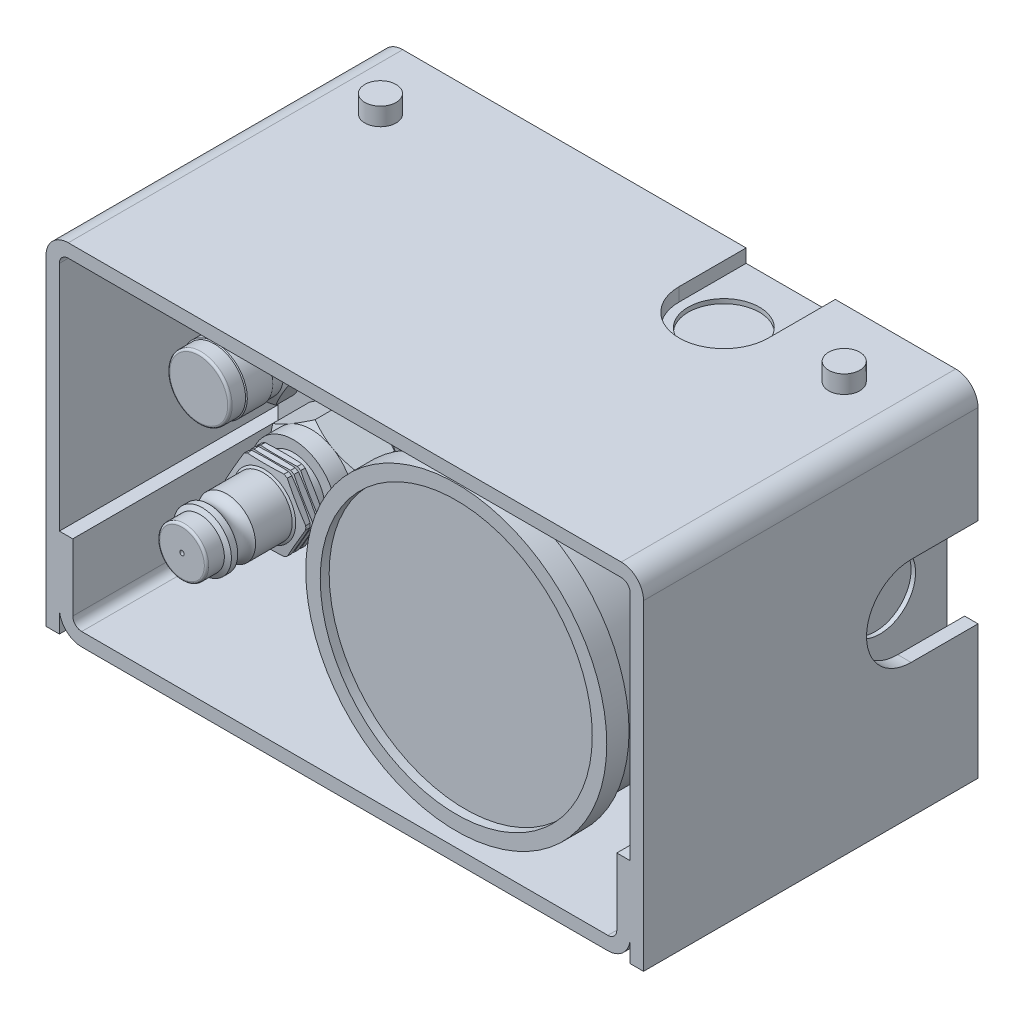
SolidWorks part; units mm, degrees
ref_plane "Front Plane" through (0, 0, 0) normal (0, 0, 1) x (1, 0, 0)
ref_plane "Top Plane" through (0, 0, 0) normal (0, 1, 0) x (1, 0, 0)
ref_plane "Right Plane" through (0, 0, 0) normal (1, 0, 0) x (0, 0, -1)
sketch "Sketch1" plane through (0, 0, 0) normal (0, 0, 1) x (1, 0, 0)
  line L0 (-60, 34) -> (60, -34) construction
  line L1 (-60, 34) -> (60, 34)
  line L2 (-60, 34) -> (-60, -34)
  line L3 (-60, -34) -> (60, -34)
  line L4 (60, 34) -> (60, -34)
  circle A0 centre (-20, 19.5) radius 5.25
  circle A1 centre (-20, -19.5) radius 5.25
  dimension "D3" = 10.5
  dimension "D1" = 68
  dimension "D2" = 120
  dimension "D4" = 14.5
  dimension "D5" = 14.5
  dimension "D6" = 40
extrude "Boss-Extrude1" add sketch "Sketch1" along normal mid plane 30
sketch "Sketch2" plane through (0, 0, 0) normal (0, 0, 1) x (1, 0, 0)
  line L0 (-64.9641, 0) -> (69.6651, 0) construction
  line L1 (-60, 0) -> (-60, 8)
  line L2 (-60, 34) -> (-60, -34) construction
  line L3 (-60, 8) -> (-59, 8)
  line L4 (-59, 8) -> (-59, 0)
  line L5 (-59, 0) -> (-60, 0)
  line L6 (60, -34) -> (60, 34) construction
  line L7 (59, 0) -> (60, 0)
  line L8 (59, 0) -> (59, 8)
  line L9 (59, 8) -> (60, 8)
  line L10 (60, 0) -> (60, 8)
  line L11 (-60, -34) -> (60, -34) construction
  dimension "D1" = 34
  dimension "D2" = 16
  dimension "D3" = 1
revolve "Cut-Revolve1" cut sketch "Sketch2" angle 360 about L0
sketch "Sketch4" plane through (0, 0, 0) normal (0, 0, 1) x (1, 0, 0)
  line L0 (25, 42.1777) -> (25, -44.1617) construction
  line L1 (60, 34) -> (-60, 34) construction
  line L2 (25, 33) -> (33, 33)
  line L3 (25, 33) -> (25, 34)
  line L4 (25, 34) -> (33, 34)
  line L5 (33, 33) -> (33, 34)
  line L6 (-60, -34) -> (60, -34) construction
  line L7 (25, -33) -> (33, -33)
  line L8 (25, -33) -> (25, -34)
  line L9 (25, -34) -> (33, -34)
  line L10 (33, -33) -> (33, -34)
  line L11 (-60, 34) -> (-60, -34) construction
  dimension "D1" = 16
  dimension "D2" = 1
  dimension "D3" = 85
revolve "Cut-Revolve2" cut sketch "Sketch4" angle 360 about L0
sketch "Sketch5" plane through (0, 0, 15) normal (0, 0, 1) x (1, 0, 0)
  circle A0 centre (-20, 19.5) radius 8.75
  circle A1 centre (-20, -19.5) radius 8.75
  dimension "D1" = 17.5
extrude "Cut-Extrude1" cut sketch "Sketch5" against normal blind 12
sketch "Sketch6" plane through (0, -34, 0) normal (0, -1, 0) x (1, 0, 0)
  line L0 (-60, 15) -> (-60, -15) construction
  circle A0 centre (-42, 0) radius 8
  dimension "D1" = 16
  dimension "D2" = 18
extrude "Cut-Extrude2" cut sketch "Sketch6" against normal blind 1
sketch "Sketch7" plane through (0, 0, -15) normal (0, 0, -1) x (-1, 0, 0)
  line L0 (62, 34) -> (-62, 34)
  line L1 (62, 37) -> (-62, 37)
  line L2 (67, 32) -> (67, -40)
  line L3 (59, -40) -> (-59, -40)
  line L4 (-67, 32) -> (-67, -40)
  line L5 (-64, 32) -> (-64, -20)
  line L6 (59, -37) -> (-59, -37)
  line L7 (64, 32) -> (64, -20)
  line L8 (-60, 34) -> (60, 34) construction
  line L9 (0, 34) -> (0, 0) construction
  line L10 (64, 34) -> (-64, 34) construction
  line L11 (-64, 34) -> (-64, -37) construction
  line L12 (64, 34) -> (64, -37) construction
  line L13 (67, 37) -> (-67, 37) construction
  line L14 (-67, 37) -> (-67, -40) construction
  line L15 (67, 37) -> (67, -40) construction
  line L17 (61, -20) -> (61, -35)
  line L18 (-61, -20) -> (-64, -20)
  line L19 (-61, -20) -> (-61, -35)
  line L20 (64, -37) -> (-64, -37) construction
  line L21 (61, -20) -> (64, -20)
  line L22 (67, -40) -> (-67, -40) construction
  line L23 (64, -35) -> (64, -40)
  line L24 (64, -40) -> (67, -40)
  line L25 (-64, -35) -> (-64, -40)
  line L26 (-64, -40) -> (-67, -40)
  arc A0 (-62, 34) -> (-64, 32) centre (-62, 32) ccw
  arc A1 (62, 34) -> (64, 32) centre (62, 32) cw
  arc A2 (-62, 37) -> (-67, 32) centre (-62, 32) ccw
  arc A3 (62, 37) -> (67, 32) centre (62, 32) cw
  arc A4 (64, -35) -> (59, -40) centre (59, -35) cw
  arc A5 (61, -35) -> (59, -37) centre (59, -35) cw
  arc A6 (-61, -35) -> (-59, -37) centre (-59, -35) ccw
  arc A7 (-64, -35) -> (-59, -40) centre (-59, -35) ccw
  dimension "D4" = 2
  dimension "D5" = 5
  dimension "D6" = 5
  dimension "D7" = 2
  dimension "D9" = 2
  dimension "D10" = 5
  dimension "D1" = 134
  dimension "D3" = 77
  dimension "D8" = 20
  dimension "D2" = 3
extrude "Boss-Extrude2" add sketch "Sketch7" against normal blind 75
sketch "Sketch9" plane through (0, -40, 0) normal (0, -1, 0) x (1, 0, 0)
  line L0 (15, 0) -> (15, -15)
  line L2 (15, -15) -> (35, -15)
  line L3 (35, -15) -> (35, 0)
  line L4 (-52, 0) -> (-52, -15)
  line L5 (59, -15) -> (-59, -15) construction
  line L6 (-52, -15) -> (-32, -15)
  line L7 (-32, -15) -> (-32, 0)
  arc A0 (35, 0) -> (15, 0) centre (25, 0) ccw
  arc A1 (-32, 0) -> (-52, 0) centre (-42, 0) ccw
  dimension "D1" = 10
  dimension "D2" = 15
  dimension "D3" = 42
  dimension "D4" = 25
extrude "Cut-Extrude3" cut sketch "Sketch9" against normal blind 3
sketch "Sketch10" plane through (0, 37, 0) normal (0, 1, 0) x (1, 0, 0)
  line L0 (15, 15) -> (15, 0)
  line L1 (-62, 15) -> (62, 15) construction
  line L2 (15, 15) -> (35, 15)
  line L3 (35, 15) -> (35, 0)
  arc A0 (15, 0) -> (35, 0) centre (25, 0) ccw
  arc A1 (15, 0) -> (35, 0) centre (25, 0) ccw construction
extrude "Cut-Extrude4" cut sketch "Sketch10" against normal blind 3
sketch "Sketch11" plane through (-67, 0, 0) normal (-1, 0, 0) x (0, 0, 1)
  line L0 (0, 10) -> (-15, 10)
  line L1 (-15, -40) -> (-15, 32) construction
  line L2 (-15, 10) -> (-15, -10)
  line L3 (-15, -10) -> (0, -10)
  line L4 (60, 37) -> (-15, 37) construction
  arc A0 (0, -10) -> (0, 10) centre (0, 0) ccw
  dimension "D1" = 10
  dimension "D2" = 37
  dimension "D3" = 15
extrude "Cut-Extrude5" cut sketch "Sketch11" against normal blind 3
sketch "Sketch13" plane through (67, 0, 0) normal (1, 0, 0) x (0, 0, -1)
  line L0 (0, 10) -> (15, 10)
  line L1 (15, 10) -> (15, -10)
  line L2 (15, -10) -> (0, -10)
  arc A0 (0, 10) -> (0, -10) centre (0, 0) ccw
extrude "Cut-Extrude6" cut sketch "Sketch13" against normal blind 3
ref_plane "Plane1" through (25, 0, 0) normal (-1, 0, 0) x (0, 0, 1)
sketch "Sketch14" plane through (25, 0, 0) normal (-1, 0, 0) x (0, 0, 1)
  line L0 (15, 0) -> (70.5261, 0) construction
  line L1 (15, -34) -> (15, 34) construction
  line L4 (58, 0) -> (58, 30.5)
  line L5 (58, 30.5) -> (60, 30.5)
  line L6 (60, 30.5) -> (60, 33.75)
  line L7 (60, 33.75) -> (55, 33.75)
  line L8 (30, 28.25) -> (30, 8)
  line L9 (30, 8) -> (15, 8)
  line L10 (55, 33.75) -> (55, 31.25)
  line L11 (55, 31.25) -> (33, 31.25)
  line L12 (15, 0) -> (58, 0)
  line L13 (15, 0) -> (15, 8)
  line L14 (15, 8) -> (15, 0)
  arc A0 (33, 31.25) -> (30, 28.25) centre (33, 28.25) ccw
  dimension "D1" = 62.5
  dimension "D3" = 3
  dimension "D2" = 67.5
  dimension "D4" = 15
  dimension "D5" = 16
  dimension "D6" = 5
  dimension "D7" = 2
  dimension "D8" = 61
  dimension "D9" = 30
revolve "Revolve2" add sketch "Sketch14" angle 360 about L0
ref_plane "Plane2" through (-42, 0, 0) normal (-1, 0, 0) x (0, 0, 1)
sketch "Sketch15" plane through (-42, 0, 0) normal (-1, 0, 0) x (0, 0, 1)
  line L0 (15, 14) -> (68.8164, 14) construction
  line L1 (15, -34) -> (15, 34) construction
  line L2 (60, 34) -> (-15, 34) construction
  line L3 (15, 14) -> (15, 21)
  line L4 (15, 21) -> (21, 21)
  line L5 (21, 21) -> (23.3094, 25)
  line L6 (23.3094, 25) -> (24.6906, 25)
  line L7 (24.6906, 25) -> (27, 21)
  line L9 (27, 21) -> (27, 19.5)
  line L10 (50.75, 14) -> (50.75, 20.5)
  line L11 (50.25, 21) -> (47.25, 21)
  line L12 (47.25, 21) -> (47.1057, 21.25)
  line L13 (47.1057, 21.25) -> (41.3943, 21.25)
  line L14 (41.3943, 21.25) -> (41.25, 21)
  line L15 (41.25, 21) -> (38.75, 21)
  line L16 (38.75, 21) -> (36.4406, 25)
  line L17 (36.4406, 25) -> (35.0594, 25)
  line L18 (35.0594, 25) -> (32.75, 21)
  line L19 (32.75, 21) -> (29, 21)
  line L20 (29, 21) -> (28.7113, 20.5)
  line L21 (28.7113, 20.5) -> (28, 20.5)
  line L22 (28, 20.5) -> (27, 19.5)
  line L23 (15, 14) -> (50.75, 14)
  arc A0 (50.75, 20.5) -> (50.25, 21) centre (50.25, 20.5) ccw
  dimension "D25" = 0.5
  dimension "D1" = 20
  dimension "D2" = 14
  dimension "D3" = 6
  dimension "D4" = 60
  dimension "D5" = 60
  dimension "D6" = 60
  dimension "D7" = 60
  dimension "D8" = 14
  dimension "D9" = 14.5
  dimension "D10" = 3.5
  dimension "D11" = 9.5
  dimension "D12" = 35.75
  dimension "D13" = 12
  dimension "D14" = 60
  dimension "D15" = 60
  dimension "D16" = 45
  dimension "D17" = 60
  dimension "D18" = 18
  dimension "D19" = 12
  dimension "D20" = 13
  dimension "D21" = 1
  dimension "D22" = 2
  dimension "D23" = 22
  dimension "D24" = 22
revolve "Revolve3" add sketch "Sketch15" angle 360 about L0
sketch "Sketch16" plane through (0, 0, 50.75) normal (0, 0, 1) x (1, 0, 0)
  line L1 (-37.6699, 6.5) -> (-33.3397, 14)
  line L2 (-33.3397, 14) -> (-37.6699, 21.5)
  line L3 (-37.6699, 21.5) -> (-46.3301, 21.5)
  line L4 (-46.3301, 21.5) -> (-50.6603, 14)
  line L5 (-50.6603, 14) -> (-46.3301, 6.5)
  line L6 (-46.3301, 6.5) -> (-37.6699, 6.5)
  circle A0 centre (-42, 14) radius 7.5 construction
  circle A1 centre (-42, 14) radius 12
  dimension "D2" = 24
  dimension "D1" = 15
extrude "Cut-Extrude8" cut sketch "Sketch16" against normal blind 20
sketch "Sketch17" plane through (0, 0, 15) normal (0, 0, 1) x (1, 0, 0)
  line L1 (-42, 5.9171) -> (-35, 9.9585)
  line L2 (-35, 9.9585) -> (-35, 18.0415)
  line L3 (-35, 18.0415) -> (-42, 22.0829)
  line L4 (-42, 22.0829) -> (-49, 18.0415)
  line L5 (-49, 18.0415) -> (-49, 9.9585)
  line L6 (-49, 9.9585) -> (-42, 5.9171)
  circle A0 centre (-42, 14) radius 7 construction
  circle A1 centre (-42, 14) radius 12
  dimension "D2" = 24
  dimension "D1" = 14
extrude "Cut-Extrude9" cut sketch "Sketch17" along normal blind 15
sketch "Sketch19" plane through (0, 0, 15) normal (0, 0, 1) x (1, 0, 0)
  line L0 (-60, 34) -> (-60, -34) construction
  line L2 (-60, -34) -> (60, -34) construction
  circle A0 centre (-42, -16) radius 11
  dimension "D1" = 22
  dimension "D2" = 18
  dimension "D3" = 18
extrude "Cut-Extrude10" cut sketch "Sketch19" against normal blind 0.5
sketch "Sketch20" plane through (-42, 0, 0) normal (-1, 0, 0) x (0, 0, 1)
  line L0 (14.5, -16) -> (70.7865, -16) construction
  line L1 (14.5, -27) -> (14.5, -5) construction
  line L2 (14.5, -16) -> (14.5, -6)
  line L3 (14.5, -6) -> (15.5, -6)
  line L4 (14.5, -16) -> (49.5, -16)
  line L5 (49.5, -16) -> (49.5, -15.5)
  line L6 (49.5, -15.5) -> (54.5, -15.5)
  line L7 (54.5, -15.5) -> (54.5, -11)
  line L8 (49.9226, -9.5) -> (48.5, -9.5)
  line L9 (15.5, -6.5) -> (18.6754, -1)
  line L10 (18.6754, -1) -> (22.3246, -1)
  line L11 (22.3246, -1) -> (25.5, -6.5)
  line L12 (25.5, -6.5) -> (29.5, -6.5)
  line L13 (15.5, -6.5) -> (15.5, -6)
  line L14 (29.5, -6.5) -> (29.5, -9)
  line L15 (49.9226, -9.5) -> (50.5, -10.5)
  line L16 (50.5, -10.5) -> (54, -10.5)
  line L17 (44.5, -9.5) -> (36.2887, -9.5)
  line L18 (29.5, -9) -> (31.5, -9)
  line L19 (31.5, -9) -> (31.75, -7)
  line L20 (31.75, -7) -> (32.75, -7)
  line L21 (32.75, -7) -> (33, -9)
  line L22 (33, -9) -> (33.25, -7)
  line L23 (33.25, -7) -> (34.25, -7)
  line L24 (34.25, -7) -> (34.5, -9)
  line L25 (34.5, -9) -> (34.75, -7)
  line L26 (34.75, -7) -> (35.75, -7)
  line L27 (35.75, -7) -> (36, -9)
  line L28 (36, -9) -> (36.2887, -9.5)
  arc A0 (44.5, -9.5) -> (48.5, -9.5) centre (46.5, -8) ccw
  arc A1 (54, -10.5) -> (54.5, -11) centre (54, -11) cw
  point P51 (54.5, -10.5)
  dimension "D24" = 0.5
  dimension "D1" = 20
  dimension "D2" = 1
  dimension "D3" = 5
  dimension "D4" = 1
  dimension "D5" = 19
  dimension "D6" = 60
  dimension "D7" = 60
  dimension "D8" = 14
  dimension "D9" = 4
  dimension "D10" = 30
  dimension "D11" = 60
  dimension "D12" = 4
  dimension "D13" = 6
  dimension "D14" = 13
  dimension "D15" = 11
  dimension "D16" = 40
  dimension "D17" = 4
  dimension "D18" = 14
  dimension "D19" = 60
  dimension "D20" = 1.5
  dimension "D21" = 2
  dimension "D22" = 1
  dimension "D23" = 18
revolve "Revolve4" add sketch "Sketch20" angle 360 about L0
sketch "Sketch21" plane through (0, 0, 54.5) normal (0, 0, 1) x (1, 0, 0)
  line L1 (-32.7624, -16) -> (-37.3812, -8)
  line L2 (-37.3812, -8) -> (-46.6188, -8)
  line L3 (-46.6188, -8) -> (-51.2376, -16)
  line L4 (-51.2376, -16) -> (-46.6188, -24)
  line L5 (-46.6188, -24) -> (-37.3812, -24)
  line L6 (-37.3812, -24) -> (-32.7624, -16)
  circle A0 centre (-42, -16) radius 8 construction
  circle A1 centre (-42, -16) radius 12.5
  dimension "D2" = 25
  dimension "D1" = 16
extrude "Cut-Extrude11" cut sketch "Sketch21" against normal blind 25
sketch "Sketch22" plane through (0, 0, 54.5) normal (0, 0, 1) x (1, 0, 0)
  line L1 (-42, -26.9697) -> (-32.5, -21.4848)
  line L2 (-32.5, -21.4848) -> (-32.5, -10.5152)
  line L3 (-32.5, -10.5152) -> (-42, -5.0303)
  line L4 (-42, -5.0303) -> (-51.5, -10.5152)
  line L5 (-51.5, -10.5152) -> (-51.5, -21.4848)
  line L6 (-51.5, -21.4848) -> (-42, -26.9697)
  circle A0 centre (-42, -16) radius 9.5 construction
  circle A1 centre (-42, -16) radius 16
  dimension "D1" = 19
  dimension "D2" = 32
extrude "Cut-Extrude13" cut sketch "Sketch22" against normal blind 39
sketch "Sketch23" plane through (0, 0, 0) normal (0, 0, 1) x (1, 0, 0)
  line L0 (-52, 37) -> (-52, 41)
  line L1 (-62, 37) -> (62, 37) construction
  line L2 (-52, 41) -> (-55.5, 41)
  line L3 (-55.5, 41) -> (-55.5, 37)
  line L4 (-55.5, 37) -> (-52, 37)
  line L5 (-60, 34) -> (-60, -34) construction
  dimension "D1" = 3.5
  dimension "D2" = 4
  dimension "D3" = 8
revolve "Revolve5" add sketch "Sketch23" angle 360 about L0
sketch "Sketch24" plane through (0, 0, 0) normal (0, 0, 1) x (1, 0, 0)
  line L0 (60, -34) -> (60, 34) construction
  line L1 (-62, 37) -> (62, 37) construction
  line L3 (55.5, 37) -> (52, 37)
  line L4 (55.5, 37) -> (55.5, 41)
  line L5 (55.5, 41) -> (52, 41)
  line L6 (52, 37) -> (52, 41)
  dimension "D1" = 8
  dimension "D2" = 3.5
  dimension "D3" = 4
revolve "Revolve6" add sketch "Sketch24" angle 360 about L6
